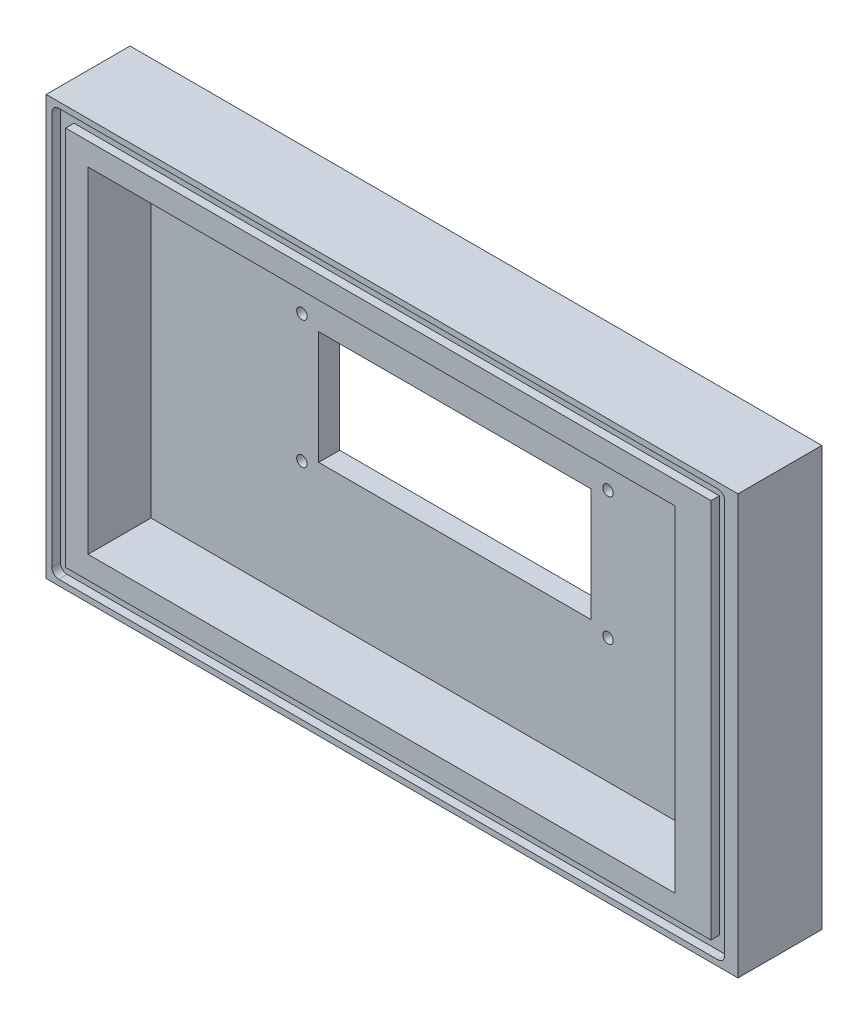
SolidWorks part; units mm, degrees
ref_plane "Ebene vorne" through (0, 0, 0) normal (0, 0, 1) x (1, 0, 0)
ref_plane "Ebene oben" through (0, 0, 0) normal (0, 1, 0) x (1, 0, 0)
ref_plane "Ebene rechts" through (0, 0, 0) normal (1, 0, 0) x (0, 0, -1)
sketch "Skizze1" plane through (0, 0, 0) normal (0, 0, 1) x (1, 0, 0)
  line L0 (-69.8709, 52.1673) -> (95.1291, -47.8327) construction
  line L1 (-69.8709, 52.1673) -> (95.1291, 52.1673)
  line L2 (-69.8709, 52.1673) -> (-69.8709, -47.8327)
  line L3 (-69.8709, -47.8327) -> (95.1291, -47.8327)
  line L4 (95.1291, 52.1673) -> (95.1291, -47.8327)
  line L5 (95.1291, 52.1673) -> (-69.8709, -47.8327) construction
  line L6 (-69.8709, 2.1673) -> (95.1291, 2.1673) construction
  line L7 (12.6291, 52.1673) -> (12.6291, -47.8327) construction
  point P12 (0, 0)
  dimension "D1" = 165
  dimension "D2" = 100
extrude "Aufsatz-Linear austragen1" add sketch "Skizze1" along normal blind 20
sketch "Skizze3" plane through (0, 0, 20) normal (0, 0, 1) x (1, 0, 0)
  line L0 (95.1291, 52.1673) -> (-69.8709, 52.1673) construction
  line L1 (-59.8709, 42.1673) -> (80.1291, 42.1673)
  line L2 (-59.8709, 42.1673) -> (-59.8709, -37.8327)
  line L3 (-59.8709, -37.8327) -> (80.1291, -37.8327)
  line L4 (80.1291, 42.1673) -> (80.1291, -37.8327)
  line L5 (-69.8709, 52.1673) -> (-69.8709, -47.8327) construction
  dimension "D1" = 140
  dimension "D2" = 80
  dimension "D3" = 10
  dimension "D4" = 10
extrude "Schnitt-Linear austragen1" cut sketch "Skizze3" against normal blind 15 contours L2 L1 L4 L3
sketch "Skizze4" plane through (0, 0, 5) normal (0, 0, 1) x (1, 0, 0)
  line L0 (95.1291, -47.8327) -> (95.1291, 52.1673) construction
  line L1 (-19.8709, 20.6673) -> (45.1291, 20.6673)
  line L2 (-19.8709, 20.6673) -> (-19.8709, -6.3327)
  line L3 (-19.8709, -6.3327) -> (45.1291, -6.3327)
  line L4 (45.1291, 20.6673) -> (45.1291, -6.3327)
  line L5 (-69.8709, -47.8327) -> (95.1291, -47.8327) construction
  line L6 (12.6291, 20.6673) -> (12.6291, -6.3327) construction
  line L7 (-19.8709, 7.1673) -> (45.1291, 7.1673) construction
  line L8 (-19.8709, 20.6673) -> (45.1291, -6.3327) construction
  line L9 (45.1291, 20.6673) -> (-19.8709, -6.3327) construction
  circle A0 centre (-23.8709, 22.3924) radius 1.25
  circle A1 centre (-23.8709, -8.0578) radius 1.25
  circle A2 centre (49.1291, 22.3924) radius 1.25
  circle A3 centre (49.1291, -8.0578) radius 1.25
  dimension "D5" = 2.5
  dimension "D1" = 65
  dimension "D2" = 27
  dimension "D3" = 50
  dimension "D4" = 41.5
  dimension "D6" = 4
extrude "Schnitt-Linear austragen2" cut sketch "Skizze4" against normal blind 15
sketch "Skizze6" plane through (0, 0, 20) normal (0, 0, 1) x (1, 0, 0)
  line L0 (-66.8544, 49.1673) -> (90.3246, 49.1673) construction
  line L1 (-66.8544, 50.7944) -> (90.3246, 50.7944)
  line L2 (-66.8544, 47.5402) -> (90.3246, 47.5402)
  line L3 (90.3246, 49.1673) -> (90.3246, -44.8327) construction
  line L4 (91.9546, 49.1673) -> (91.9546, -44.8327)
  line L5 (88.6946, 49.1673) -> (88.6946, -44.8327)
  line L6 (90.3246, -44.8327) -> (-66.8709, -44.8327) construction
  line L7 (90.3246, -46.4627) -> (-66.8709, -46.4627)
  line L8 (90.3246, -43.2027) -> (-66.8709, -43.2027)
  line L9 (-66.8709, -44.8327) -> (-66.8544, 49.1673) construction
  line L10 (-68.5009, -44.8324) -> (-68.4844, 49.1676)
  line L11 (-65.2409, -44.833) -> (-65.2244, 49.167)
  line L12 (-69.8709, 52.1673) -> (-69.8709, -47.8327) construction
  line L13 (95.1291, 52.1673) -> (-69.8709, 52.1673) construction
  line L14 (-69.8709, -47.8327) -> (95.1291, -47.8327) construction
  arc A0 (-66.8544, 50.7944) -> (-66.8544, 47.5402) centre (-66.8544, 49.1673) ccw
  arc A1 (90.3246, 47.5402) -> (90.3246, 50.7944) centre (90.3246, 49.1673) ccw
  arc A2 (91.9546, 49.1673) -> (88.6946, 49.1673) centre (90.3246, 49.1673) ccw
  arc A3 (88.6946, -44.8327) -> (91.9546, -44.8327) centre (90.3246, -44.8327) ccw
  arc A4 (90.3246, -46.4627) -> (90.3246, -43.2027) centre (90.3246, -44.8327) ccw
  arc A5 (-66.8709, -43.2027) -> (-66.8709, -46.4627) centre (-66.8709, -44.8327) ccw
  arc A6 (-68.5009, -44.8324) -> (-65.2409, -44.833) centre (-66.8709, -44.8327) ccw
  arc A7 (-65.2244, 49.167) -> (-68.4844, 49.1676) centre (-66.8544, 49.1673) ccw
  point P2 (11.7351, 49.1673)
  point P7 (90.3246, 2.1673)
  point P14 (11.7268, -44.8327)
  point P21 (-66.8626, 2.1673)
  dimension "D1" = 1.6271
  dimension "D2" = 1.63
  dimension "D3" = 1.63
  dimension "D4" = 1.63
  dimension "D5" = 3
  dimension "D6" = 3
  dimension "D7" = 3
  dimension "D8" = 3
extrude "Schnitt-Linear austragen5" cut sketch "Skizze6" against normal blind 2 contours A7 L11 L2 L5 A2 L1 | L1 A7 L10 A5 L8 L11 L2 A0 | A6 L7 A3 L5 L8 L11 | A4 L4 A2 L1 A1 L2 L5 L8 | L11 A7 L1 A0 L2 | L1 A2 L5 L2 A1 | A3 A4 L8 L5 | A5 A6 L11 L8
